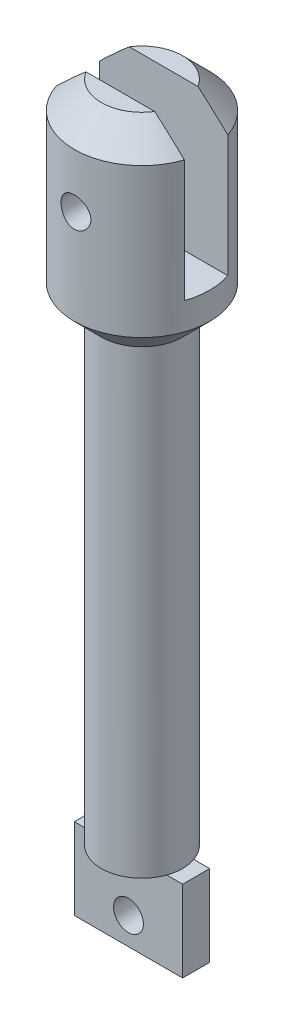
SolidWorks part; units mm, degrees
ref_plane "Front Plane" through (0, 0, 0) normal (0, 0, 1) x (1, 0, 0)
ref_plane "Top Plane" through (0, 0, 0) normal (0, 1, 0) x (1, 0, 0)
ref_plane "Right Plane" through (0, 0, 0) normal (1, 0, 0) x (0, 0, -1)
sketch "Sketch1" plane through (0, 0, 0) normal (0, 1, 0) x (1, 0, 0)
  circle A0 centre (0, 0) radius 1.5
  dimension "D1" = 3
extrude "Boss-Extrude1" add sketch "Sketch1" along normal mid plane 17
sketch "Sketch2" plane through (0, 8.5, 0) normal (0, 1, 0) x (1, 0, 0)
  circle A0 centre (0, 0) radius 2.5
  dimension "D1" = 5
extrude "Boss-Extrude2" add sketch "Sketch2" along normal blind 7.5
chamfer "Chamfer1" distance 1 angle 45 2 edges at (0, 8.5, 2.5) (0, 16, 2.5)
sketch "Sketch3" plane through (0, 0, 0) normal (0, 0, 1) x (1, 0, 0)
  line L0 (-1.5, -8.5) -> (1.5, -8.5) construction
  line L2 (-2, -8.5) -> (2, -8.5)
  line L3 (-2, -8.5) -> (-2, -11.5)
  line L4 (-2, -11.5) -> (2, -11.5)
  line L5 (2, -8.5) -> (2, -11.5)
  dimension "D1" = 4
  dimension "D2" = 2
  dimension "D3" = 3
extrude "Boss-Extrude3" add sketch "Sketch3" along normal mid plane 1
sketch "Sketch4" plane through (0, 0, 0.5) normal (0, 0, 1) x (1, 0, 0)
  line L0 (-2, -11.5) -> (2, -11.5) construction
  circle A0 centre (0, -10.5) radius 0.55
  dimension "D2" = 1.1
  dimension "D1" = 1
extrude "Cut-Extrude1" cut sketch "Sketch4" against normal through all
sketch "Sketch5" plane through (0, 16, 0) normal (0, 1, 0) x (1, 0, 0)
  line L1 (-2.75, -0.8) -> (2.75, -0.8)
  line L2 (-2.75, -0.8) -> (-2.75, 0.8)
  line L3 (-2.75, 0.8) -> (2.75, 0.8)
  line L4 (2.75, -0.8) -> (2.75, 0.8)
  line L5 (-2.75, -0.8) -> (2.75, 0.8) construction
  line L6 (-2.75, 0.8) -> (2.75, -0.8) construction
  point P0 (0, 0)
  dimension "D1" = 1.6
  dimension "D2" = 5.5
extrude "Cut-Extrude2" cut sketch "Sketch5" against normal blind 5.5
sketch "Sketch6" plane through (0, 0, 0) normal (0, 0, 1) x (1, 0, 0)
  line L0 (1.2689, 16) -> (-1.2689, 16) construction
  circle A0 centre (0, 13) radius 0.55
  dimension "D1" = 1.1
  dimension "D2" = 3
extrude "Cut-Extrude3" cut sketch "Sketch6" against normal through all both and the other way through all
